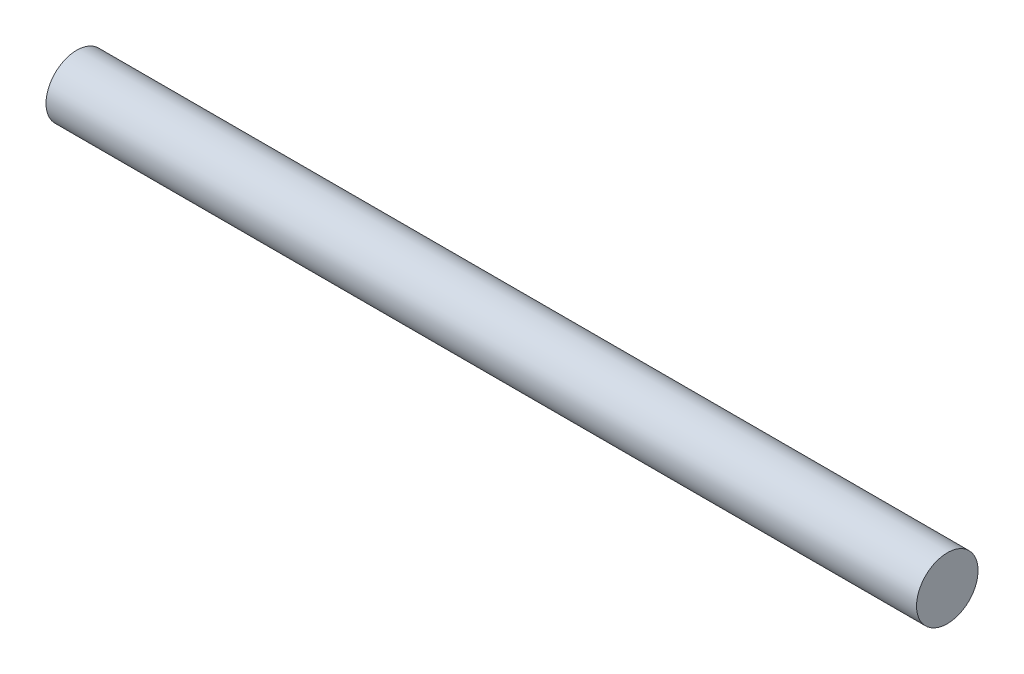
SolidWorks part; units mm, degrees
ref_plane "Face" through (0, 0, 0) normal (0, 0, 1) x (1, 0, 0)
ref_plane "Dessus" through (0, 0, 0) normal (0, 1, 0) x (1, 0, 0)
ref_plane "Droite" through (0, 0, 0) normal (1, 0, 0) x (0, 0, -1)
sketch "Esquisse1" plane through (0, 0, 0) normal (0, 0, 1) x (1, 0, 0)
  line L0 (-43.285, 4) -> (-43.285, -1)
  line L3 (-43.285, 4) -> (98.2287, 4)
  line L4 (98.2287, 4) -> (98.2287, -1)
  line L5 (-43.285, -1) -> (98.2287, -1)
  line L6 (-40, -1) -> (100, -1) construction
  dimension "D3" = 5
revolve "Base-Révolution" add sketch "Esquisse1" angle 360 about L6
